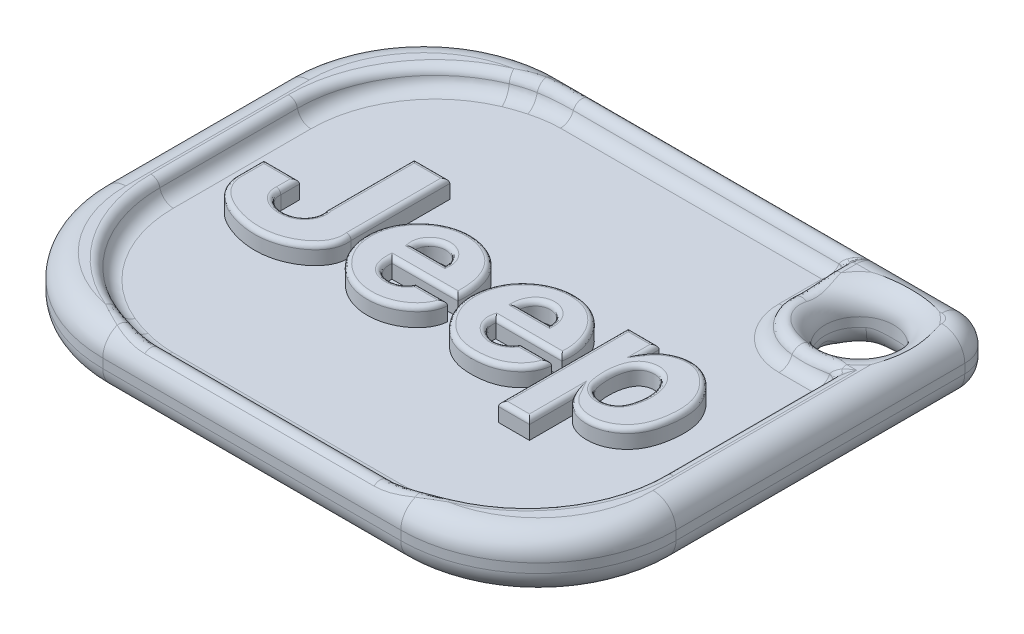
SolidWorks part; units mm, degrees
ref_plane "Ön Düzlem" through (0, 0, 0) normal (0, 0, 1) x (1, 0, 0)
ref_plane "Üst Düzlem" through (0, 0, 0) normal (0, 1, 0) x (1, 0, 0)
ref_plane "Sağ Düzlem" through (0, 0, 0) normal (1, 0, 0) x (0, 0, -1)
sketch "Çizim1" plane through (0, 0, 0) normal (0, 1, 0) x (1, 0, 0)
  line L1 (-41.6667, 37.8333) -> (53.3333, 37.8333)
  line L2 (-71.6667, 7.8333) -> (-71.6667, -32.1667)
  line L3 (-41.6667, -62.1667) -> (23.3333, -62.1667)
  line L4 (53.3333, 37.8333) -> (53.3333, -32.1667)
  arc A0 (23.3333, -62.1667) -> (53.3333, -32.1667) centre (23.3333, -32.1667) ccw
  arc A1 (-71.6667, -32.1667) -> (-41.6667, -62.1667) centre (-41.6667, -32.1667) ccw
  arc A2 (-41.6667, 37.8333) -> (-71.6667, 7.8333) centre (-41.6667, 7.8333) ccw
  circle A3 centre (38.3333, 22.8333) radius 7.5
  point P8 (-71.6667, -62.1667)
  point P11 (-71.6667, 37.8333)
  dimension "D3" = 30
  dimension "D4" = 15
  dimension "D1" = 100
  dimension "D2" = 125
  dimension "D5" = 15
extrude "Yükseklik-Ekstrüzyon1" add sketch "Çizim1" along normal blind 12
sketch "Çizim2" plane through (0, 12, 0) normal (0, 1, 0) x (1, 0, 0)
  line L0 (53.3333, 37.8333) -> (-41.6667, 37.8333) construction
  line L1 (-34.1667, 32.8333) -> (25.8333, 32.8333)
  line L2 (-64.1667, 2.8333) -> (-64.1667, -27.1667)
  line L3 (-34.1667, -57.1667) -> (15.8333, -57.1667)
  line L4 (45.8333, 10.8333) -> (45.8333, -27.1667)
  line L5 (-71.6667, 7.8333) -> (-71.6667, -32.1667) construction
  line L8 (25.8333, 32.8333) -> (25.8333, 20.8333)
  line L9 (35.8333, 10.8333) -> (45.8333, 10.8333)
  arc A0 (15.8333, -57.1667) -> (45.8333, -27.1667) centre (15.8333, -27.1667) ccw
  arc A1 (-64.1667, -27.1667) -> (-34.1667, -57.1667) centre (-34.1667, -27.1667) ccw
  arc A2 (-34.1667, 32.8333) -> (-64.1667, 2.8333) centre (-34.1667, 2.8333) ccw
  arc A3 (25.8333, 20.8333) -> (35.8333, 10.8333) centre (35.8333, 20.8333) ccw
  point P8 (-64.1667, -57.1667)
  point P11 (-64.1667, 32.8333)
  dimension "D3" = 30
  dimension "D8" = 10
  dimension "D1" = 90
  dimension "D2" = 110
  dimension "D4" = 5
  dimension "D5" = 7.5
extrude "Kes-Ekstrüzyon1" cut sketch "Çizim2" against normal blind 4
sketch "Çizim3" plane through (0, 0, 0) normal (0, -1, 0) x (1, 0, 0)
  line L0 (-41.6667, 62.1667) -> (23.3333, 62.1667) construction
  line L1 (-34.1667, 57.1667) -> (15.8333, 57.1667)
  line L2 (-64.1667, 27.1667) -> (-64.1667, -2.8333)
  line L3 (-34.1667, -32.8333) -> (25.8333, -32.8333)
  line L4 (45.8333, 27.1667) -> (45.8333, -10.8333)
  line L6 (-71.6667, -7.8333) -> (-71.6667, 32.1667) construction
  line L11 (25.8333, -32.8333) -> (25.8333, -20.8333)
  line L12 (35.8333, -10.8333) -> (45.8333, -10.8333)
  arc A0 (25.8333, -20.8333) -> (35.8333, -10.8333) centre (35.8333, -20.8333) cw
  arc A1 (-64.1667, -2.8333) -> (-34.1667, -32.8333) centre (-34.1667, -2.8333) ccw
  arc A2 (-34.1667, 57.1667) -> (-64.1667, 27.1667) centre (-34.1667, 27.1667) ccw
  arc A3 (15.8333, 57.1667) -> (45.8333, 27.1667) centre (15.8333, 27.1667) cw
  point P14 (25.8333, -10.8333)
  point P15 (-64.1667, -32.8333)
  point P18 (-64.1667, 57.1667)
  dimension "D7" = 10
  dimension "D1" = 30
  dimension "D2" = 90
  dimension "D3" = 5
  dimension "D4" = 7.5
  dimension "D5" = 22
  dimension "D6" = 20
extrude "Kes-Ekstrüzyon2" cut sketch "Çizim3" against normal blind 4
fillet "Radyus11" radius 5 15 edges at (5.8333, 12, -37.8333) (53.3333, 12, -2.8333) (44.5465, 12, 53.3799) (-9.1667, 12, 62.1667) (-62.8799, 12, 53.3799) (-71.6667, 12, 12.1667) (5.8333, 0, -37.8333) (53.3333, 0, -2.8333) (44.5465, 0, 53.3799) (-9.1667, 0, 62.1667) (-62.8799, 0, 53.3799) (-71.6667, 0, 12.1667) (38.3333, 12, -15.3333) (-62.8799, 12, -29.0465) (-62.8799, 0, -29.0465)
fillet "Radyus12" radius 5 1 edges at (38.3333, 0, -15.3333)
fillet "Radyus13" radius 3 10 edges at (-64.1667, 4, 12.1667) (-55.3799, 4, 48.3799) (-9.1667, 4, 57.1667) (37.0465, 4, 48.3799) (45.8333, 4, 8.1667) (40.8333, 4, -10.8333) (28.7623, 4, -13.7623) (25.8333, 4, -26.8333) (-4.1667, 4, -32.8333) (-55.3799, 4, -24.0465)
fillet "Radyus14" radius 3 2 edges at (25.8333, 0, -27.8333) (38.8331, 0.024, -10.8333)
fillet "Radyus15" radius 3 4 edges at (27.2654, 0.2614, -32.8333) (45.8333, 0.3856, -12.0869) (24.5654, 3.4495, -31.5654) (44.5447, 3.464, -9.5447)
fillet "Radyus18" radius 2 7 edges at (-55.3799, 12, -24.0465) (-64.1667, 12, 12.1667) (-9.1667, 12, 57.1667) (37.0465, 12, 48.3799) (-55.3799, 12, 48.3799) (-4.1667, 12, -32.8333) (45.8333, 12, 8.1667)
fillet "Radyus19" radius 7 3 edges at (51.8689, 1.4645, -36.3689) (51.8689, 10.5355, -36.3689) (53.3333, 6, -37.8333)
fillet "Radyus20" radius 3 10 edges at (40.8333, 8, -10.8333) (25.8333, 8, -26.8333) (-4.1667, 8, -32.8333) (45.8333, 8, 8.1667) (37.0465, 8, 48.3799) (-9.1667, 8, 57.1667) (-55.3799, 8, 48.3799) (-64.1667, 8, 12.1667) (28.7623, 8, -13.7623) (-55.3799, 8, -24.0465)
fillet "Radyus23" radius 2 6 edges at (44.8333, 12, -10.8333) (38.8333, 11.976, -10.8333) (25.8333, 12, -21.8333) (25.8333, 11.6709, -34.6174) (25.8333, 12, -27.8333)
fillet "Radyus24" radius 2 5 edges at (24.5399, 8.5327, -31.8614) (44.8317, 8.6762, -9.7307) (26.2034, 11.1204, -34.163) (46.5684, 11.5492, -11.4674)
sketch "Çizim7" plane through (0, 8, 0) normal (0, 1, 0) x (1, 0, 0)
  line L0 (279.4223, 382.293) -> (1657.4223, 382.293) construction
  line L1 (-16.8116, -18.7) -> (-9.9207, -18.7)
  line L2 (-24.0127, -16.7584) -> (-9.7019, -16.698)
  line L3 (-17.1739, -11.9747) -> (-24.0127, -11.9747)
  line L4 (-56.8338, -18.4044) -> (-56.8338, -11.8679)
  line L5 (-56.8338, -11.8679) -> (-49.0726, -11.8679)
  line L6 (-49.0726, -11.8679) -> (-49.0726, -15.9439)
  line L7 (-40.529, -14.6211) -> (-40.529, 4.6324)
  line L8 (-40.529, 4.6324) -> (-32.7868, 4.6324)
  line L9 (-32.7868, 4.6324) -> (-32.7868, -16.881)
  line L10 (-1.4244, -16.698) -> (12.9823, -16.698)
  line L11 (12.7639, -18.7) -> (5.9659, -18.7)
  line L12 (-1.4244, -11.8679) -> (5.491, -11.8679)
  line L13 (21.4253, -22.5618) -> (21.4253, -32.1948)
  line L14 (21.4253, -32.1948) -> (14.6811, -32.1948)
  line L15 (14.6811, -32.1948) -> (14.6811, -3.906)
  line L16 (14.6811, -3.906) -> (21.4253, -3.906)
  line L17 (21.4253, -3.906) -> (21.4253, -6.6726)
  spline S0 degree 3 poles (-40.529, -14.6211) (-40.0215, -16.1628) (-41.3721, -19.0689) (-46.1981, -20.0887) (-49.2556, -18.0716) (-49.0726, -15.9439) knots 0 0 0 0 0.334498 0.596338 1 1 1 1
  spline S1 degree 3 poles (-56.8338, -18.4044) (-56.3198, -22.231) (-51.1001, -25.5787) (-43.1836, -26.7211) (-35.9706, -24.3933) (-32.3482, -20.1081) (-32.7868, -16.881) knots 0 0 0 0 0.318472 0.529068 0.727755 1 1 1 1
  spline S2 degree 3 poles (21.4253, -22.5618) (23.2255, -25.7081) (29.4705, -26.9589) (35.5796, -22.0524) (37.0424, -16.354) (36.9756, -10.6213) (34.311, -6.0085) (28.6662, -2.0333) (23.1661, -4.0862) (21.4253, -6.6726) knots 0 0 0 0 0.21595 0.335449 0.470104 0.579431 0.697094 0.799007 1 1 1 1
  spline S3 degree 3 poles (21.5305, -16.1676) (22.0158, -19.0504) (24.5848, -20.9941) (28.3565, -20.1345) (29.6626, -16.3034) (29.7504, -12.5772) (27.4819, -8.7547) (22.909, -9.1242) (21.4938, -13.063) (21.5305, -16.1676) (22.0158, -19.0504) (24.5848, -20.9941) knots -0.310097 -0.183567 -0.06713 0 0.09073 0.213643 0.308507 0.458402 0.575215 0.689903 0.816433 0.93287 1 1.09073 1.213643 1.308507 only from (22.1847, -18.7) to (22.1847, -18.7)
  spline S4 degree 3 poles (-1.4244, -11.8679) (-1.3893, -10.6009) (-0.2259, -8.3084) (3.8761, -8.0042) (5.5114, -10.3541) (5.491, -11.8679) knots 0 0 0 0 0.356907 0.591257 1 1 1 1
  spline S5 degree 3 poles (-1.4244, -16.698) (-1.7383, -18.1441) (-0.4797, -20.1433) (2.3296, -21.1981) (4.6177, -20.5214) (5.6924, -19.4377) (5.9659, -18.7) knots 0 0 0 0 0.371572 0.59237 0.786175 1 1 1 1
  spline S6 degree 3 poles (12.7639, -18.7) (12.5102, -21.6247) (9.1049, -25.2187) (3.1452, -26.2427) (-1.8241, -25.8164) (-6.3359, -22.4602) (-9.4319, -16.4572) (-7.9499, -8.2657) (-0.8494, -2.9519) (10.2213, -3.6851) (13.8045, -12.2846) (12.9823, -16.698) knots 0 0 0 0 0.127269 0.190192 0.266895 0.342175 0.430272 0.556135 0.676481 0.794652 1 1 1 1
  spline S7 degree 3 poles (-16.8116, -18.7) (-17.3355, -20.2077) (-19.8236, -21.4714) (-23.6038, -20.1852) (-24.0727, -17.8226) (-24.0127, -16.7584) knots 0 0 0 0 0.419153 0.688036 1 1 1 1
  spline S8 degree 3 poles (-24.0127, -11.9747) (-24.2042, -10.7566) (-23.116, -8.8669) (-19.3556, -7.8702) (-17.0558, -10.0445) (-17.1739, -11.9747) knots 0 0 0 0 0.323502 0.524565 1 1 1 1
  spline S9 degree 3 poles (-9.7019, -16.698) (-9.3774, -13.6009) (-10.0936, -8.352) (-15.9907, -3.5613) (-24.0527, -2.8555) (-31.6928, -9.5017) (-31.8102, -20.0564) (-24.0878, -26.8622) (-14.4787, -26.2107) (-10.0942, -21.448) (-9.9207, -18.7) knots 0 0 0 0 0.143724 0.209303 0.326872 0.473482 0.606114 0.748422 0.879198 1 1 1 1
extrude "Yükseklik-Ekstrüzyon5" add sketch "Çizim7" along normal blind 4
fillet "Radyus31" radius 1 27 edges at (21.4253, 12, 27.3783) (18.0532, 12, 32.1948) (14.6811, 12, 18.0504) (18.0532, 12, 3.906) (21.4253, 12, 5.2893) (2.0333, 12, 11.8679) (9.3649, 12, 18.7) (5.7789, 12, 16.698) (-20.5933, 12, 11.9747) (-13.3661, 12, 18.7) (-16.8573, 12, 16.7282) (-40.529, 12, 4.9943) (-36.6579, 12, -4.6324) (-32.7868, 12, 6.1243) (-56.8338, 12, 15.1361) (-52.9532, 12, 11.8679) (-49.0726, 12, 13.9059)
